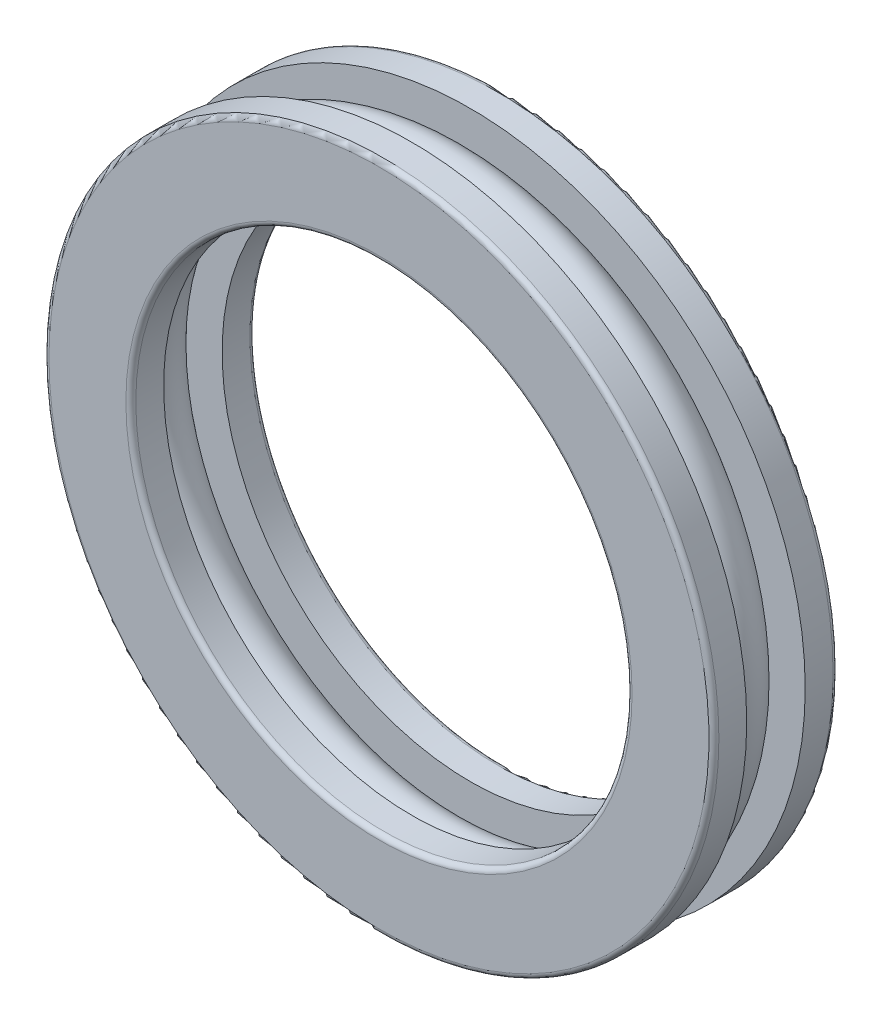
SolidWorks part; units mm, degrees
ref_plane "Спереди" through (0, 0, 0) normal (0, 0, 1) x (1, 0, 0)
ref_plane "Сверху" through (0, 0, 0) normal (0, 1, 0) x (1, 0, 0)
ref_plane "Справа" through (0, 0, 0) normal (1, 0, 0) x (0, 0, -1)
sketch "Эскиз1" plane through (0, 0, 0) normal (0, 1, 0) x (1, 0, 0)
  line L0 (0, 0) -> (0, 27.6874) construction
  line L1 (-67.5, 25) -> (-50, 0) construction
  line L2 (-67.5, 0) -> (-50, 0)
  line L3 (-67.5, 0) -> (-67.5, 6.6066)
  line L4 (-67.5, 6.6066) -> (-50, 6.6066)
  line L5 (-50, 0) -> (-50, 6.6066)
  line L6 (-67.5, 25) -> (-50, 25)
  line L7 (-67.5, 25) -> (-67.5, 18.3934)
  line L8 (-67.5, 18.3934) -> (-50, 18.3934)
  line L9 (-50, 25) -> (-50, 18.3934)
  circle A0 centre (-58.75, 12.5) radius 5.2026
  dimension "D1" = 135
  dimension "D2" = 100
  dimension "D3" = 25
revolve "Повернуть1" add sketch "Эскиз1" angle 360 about L0
fillet "Скругление1" radius 1 2 edges at (67.5, 0, 0) (50, 0, 0)
fillet "Скругление2" radius 1 2 edges at (50, 0, -25) (67.5, 0, -25)
